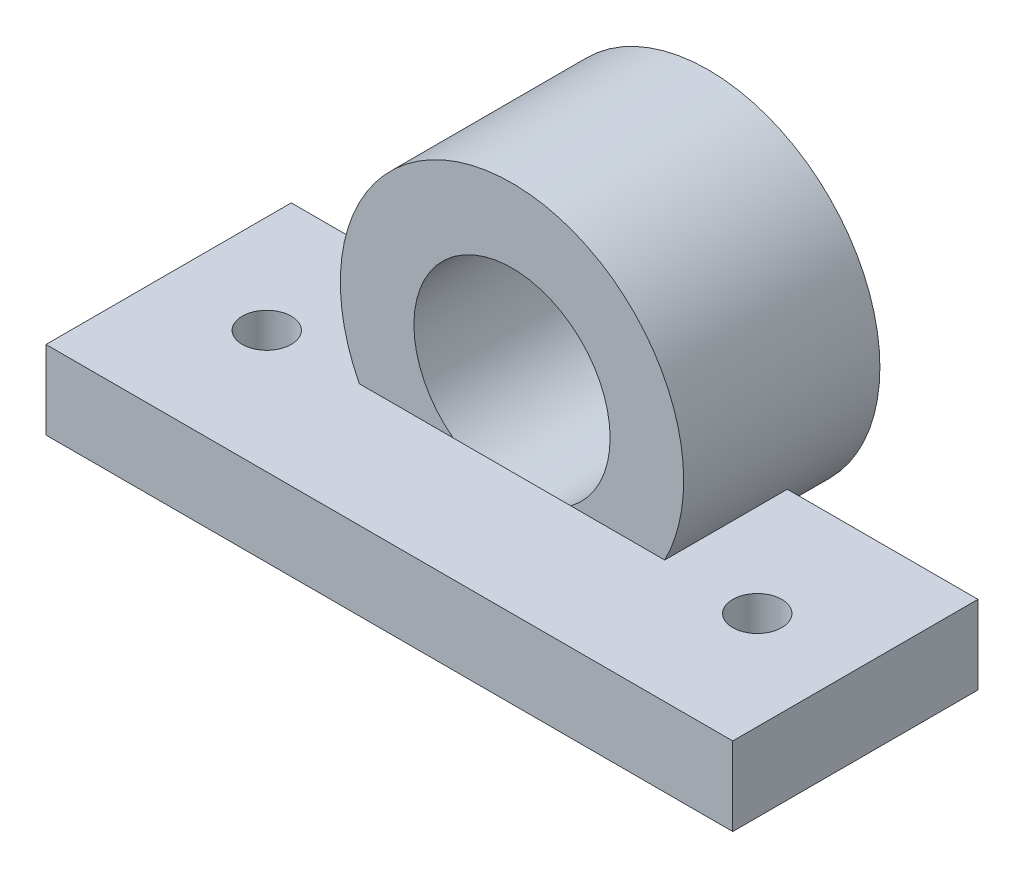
SolidWorks part; units mm, degrees
ref_plane "前视基准面" through (0, 0, 0) normal (0, 0, 1) x (1, 0, 0)
ref_plane "上视基准面" through (0, 0, 0) normal (0, 1, 0) x (1, 0, 0)
ref_plane "右视基准面" through (0, 0, 0) normal (1, 0, 0) x (0, 0, -1)
other "Configuration Table"
sketch "草图1" plane through (0, 0, 0) normal (0, 1, 0) x (1, 0, 0)
  line L1 (-70, -25) -> (70, -25)
  line L2 (-70, -25) -> (-70, 25)
  line L3 (-70, 25) -> (70, 25)
  line L4 (70, -25) -> (70, 25)
extrude "凸台-拉伸1" add sketch "草图1" against normal blind 16
sketch "草图2" plane through (0, 0, 0) normal (0, 0, 1) x (1, 0, 0)
  circle A0 centre (0, 16) radius 35
extrude "凸台-拉伸2" add sketch "草图2" against normal blind 40
sketch "草图3" plane through (0, 0, 0) normal (0, 0, 1) x (1, 0, 0)
  circle A0 centre (0, 16) radius 20
extrude "切除-拉伸1" cut sketch "草图3" against normal blind 40
sketch "草图4" plane through (0, 0, 0) normal (0, 1, 0) x (1, 0, 0)
  circle A0 centre (-50, 0) radius 5
  circle A1 centre (50, 0) radius 5
extrude "切除-拉伸2" cut sketch "草图4" against normal blind 16
